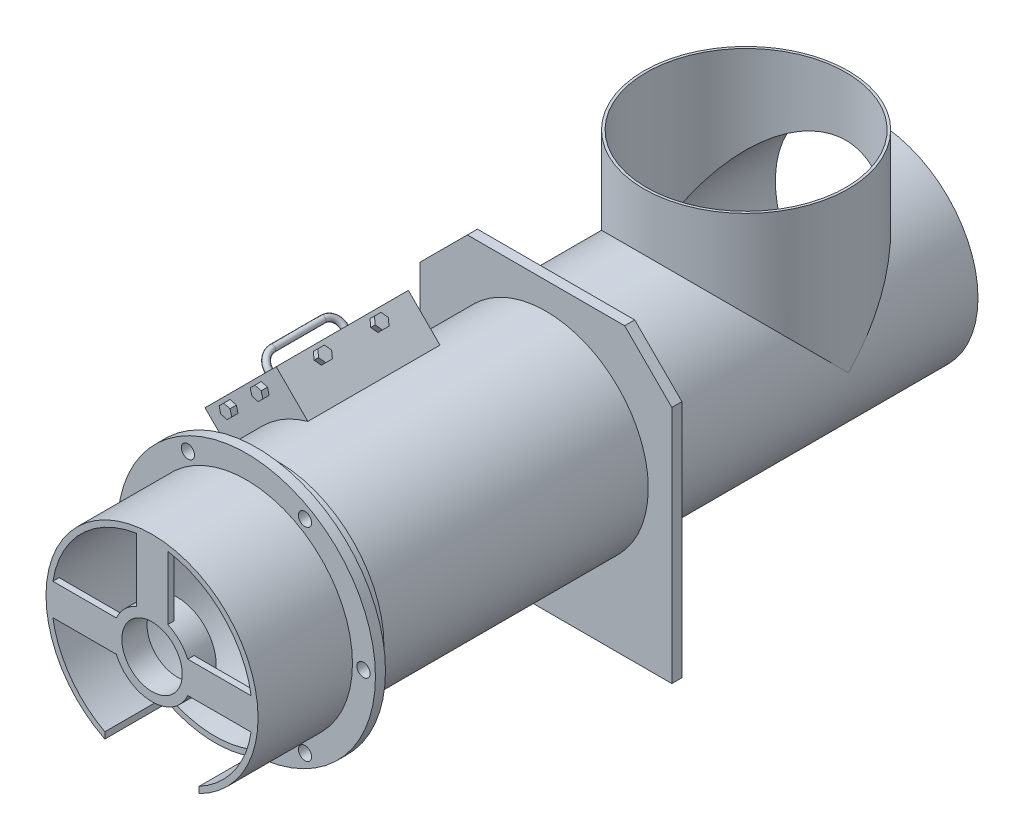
SolidWorks part; units mm, degrees
ref_plane "Front Plane" through (0, 0, 0) normal (0, 0, 1) x (1, 0, 0)
ref_plane "Top Plane" through (0, 0, 0) normal (0, 1, 0) x (1, 0, 0)
ref_plane "Right Plane" through (0, 0, 0) normal (1, 0, 0) x (0, 0, -1)
sketch "Sketch1" plane through (0, 0, 0) normal (0, 0, 1) x (1, 0, 0)
  circle A0 centre (0, 0) radius 162.5
  circle A1 centre (0, 0) radius 159.5
  dimension "D1" = 325
  dimension "D2" = 3
extrude "Boss-Extrude1" add sketch "Sketch1" along normal blind 950 contours A0 | A1
ref_plane "Plane1" through (0, 253, 0) normal (0, 1, 0) x (1, 0, 0)
sketch "Sketch4" plane through (0, 253, 0) normal (0, 1, 0) x (1, 0, 0)
  line L0 (0, 0) -> (0, -206) construction
  circle A0 centre (0, -206) radius 162.5
  point P0 (0, -206)
  dimension "D1" = 325
  dimension "D2" = 206
sketch "Sketch8" plane through (0, 0, 0) normal (1, 0, 0) x (0, 0, -1)
  line L0 (-950, 162.5) -> (-950, -162.5) construction
  line L1 (-950, 159.5) -> (-1150, 159.5)
  line L2 (-950, 159.5) -> (-950, 168.5)
  line L3 (-950, 168.5) -> (-984, 168.5)
  line L4 (-1150, 159.5) -> (-1150, 168.5)
  line L5 (0, 159.5) -> (-950, 159.5) construction
  line L6 (-1000, 168.5) -> (-1150, 168.5)
  line L8 (-1000, 168.5) -> (-1000, 205)
  line L9 (-1000, 205) -> (-984, 205)
  line L10 (-984, 168.5) -> (-984, 205)
  dimension "D1" = 200
  dimension "D2" = 168.5
  dimension "D3" = 150
  dimension "D4" = 16
  dimension "D5" = 205
ref_axis "Axis2" through (0, 0, 950) along (0, 0, -1)
revolve "Revolve2" add sketch "Sketch8" angle 360 about axis through (0, 0, 950) along (0, 0, -1)
sketch "Sketch2" plane through (0, 0, 0) normal (0, 1, 0) x (1, 0, 0)
  line L1 (-75, -1150) -> (75, -1150)
  line L2 (-75, -1150) -> (-75, -1050)
  line L3 (-75, -1050) -> (75, -1050)
  line L4 (75, -1150) -> (75, -1050)
  line L5 (0, -1050) -> (0, 0) construction
  line L6 (-159.5, -1150) -> (159.5, -1150) construction
  dimension "D1" = 100
  dimension "D2" = 150
extrude "Cut-Extrude1" cut sketch "Sketch2" against normal through all
sketch "Sketch11" plane through (0, 0, 1000) normal (0, 0, 1) x (1, 0, 0)
  line L0 (186, 0) -> (0, 0) construction
  circle A0 centre (0, 0) radius 186 construction
  circle A1 centre (186, 0) radius 10.5
  dimension "D1" = 372
  dimension "D2" = 21
extrude "Cut-Extrude4" cut sketch "Sketch11" against normal up to surface (16 mm away)
pattern_circular "CirPattern2" count 6 over 360 about axis through (0, 0, 0) along (0, 0, 1) of "Cut-Extrude4"
ref_plane "Plane2" through (0, 0, 524) normal (0, 0, -1) x (-1, 0, 0)
sketch "Sketch13" plane through (0, 0, 524) normal (0, 0, -1) x (-1, 0, 0)
  line L0 (0, -250) -> (0, 0) construction
  line L1 (-200, -250) -> (200, -250)
  line L2 (-200, -250) -> (-200, 205)
  line L3 (-200, 205) -> (200, 205)
  line L4 (200, -250) -> (200, 205)
  circle A0 centre (0, 0) radius 162.5
  circle A1 centre (0, 0) radius 162.5 construction
  dimension "D1" = 250
  dimension "D2" = 205
  dimension "D3" = 400
extrude "Boss-Extrude3" add sketch "Sketch13" along normal blind 16 separate body
chamfer "Chamfer1" distance 75 angle 45 2 edges at (200, 205, 516) (-200, 205, 516)
sketch "Sketch14" plane through (0, 0, 0) normal (1, 0, 0) x (0, 0, -1)
  line L0 (-1150, 168.5) -> (-1150, -150.8882) construction
  line L1 (-1150, 48) -> (-1110, 48)
  line L2 (-1150, 48) -> (-1150, 62)
  line L3 (-1150, 62) -> (-1110, 62)
  line L4 (-1110, 48) -> (-1110, 62)
  line L5 (-1150, 48) -> (-1110, 62) construction
  line L6 (-1150, 62) -> (-1110, 48) construction
  line L8 (-950, 0) -> (0, 0) construction
  point P0 (-1130, 55)
  dimension "D1" = 48
  dimension "D2" = 62
  dimension "D3" = 40
revolve "Revolve3" add sketch "Sketch14" angle 360 about axis through (0, 0, 950) along (0, 0, -1)
sketch "Sketch15" plane through (0, 0, 1150) normal (0, 0, 1) x (1, 0, 0)
  line L0 (62, 0) -> (0, 0) construction
  line L1 (56.7362, -25) -> (157.5286, -25)
  line L3 (56.7362, 25) -> (157.5286, 25)
  circle A0 centre (0, 0) radius 62 construction
  arc A1 (75, -140.7667) -> (-75, -140.7667) centre (0, 0) ccw construction
  arc A2 (56.7362, 25) -> (56.7362, -25) centre (0, 0) cw
  arc A3 (157.5286, 25) -> (157.5286, -25) centre (0, 0) cw
  dimension "D1" = 50
extrude "Boss-Extrude4" add sketch "Sketch15" against normal blind 10
pattern_circular "CirPattern3" count 4 over 360 about axis through (0, 0, 950) along (0, 0, -1) of "Boss-Extrude4"
ref_plane "Plane3" through (0, 0, 0) normal (-0.7071, 0.7071, 0) x (0, 0, -1)
ref_plane "Plane4" through (-114.9049, 114.9049, 0) normal (-0.7071, 0.7071, 0) x (0, 0, -1)
ref_plane "Plane5" through (-150.2602, 150.2602, 0) normal (-0.7071, 0.7071, 0) x (0, 0, -1)
sketch "Sketch16" plane through (-150.2602, 150.2602, 0) normal (-0.7071, 0.7071, 0) x (0, 0, -1)
  line L0 (-950, 0) -> (0, 0) construction
  line L1 (-859, -80) -> (-649, -80)
  line L2 (-859, -80) -> (-859, 80)
  line L3 (-859, 80) -> (-649, 80)
  line L4 (-649, -80) -> (-649, 80)
  line L5 (-859, -80) -> (-649, 80) construction
  line L6 (-859, 80) -> (-649, -80) construction
  line L7 (-524, -225.5) -> (-524, 225.5) construction
  line L8 (-855, 76) -> (-653, 76)
  line L9 (-653, -76) -> (-653, 76)
  line L10 (-855, -76) -> (-653, -76)
  line L11 (-855, -76) -> (-855, 76)
  point P0 (-754, 0)
  dimension "D1" = 210
  dimension "D2" = 160
  dimension "D3" = 230
  dimension "D4" = 4
extrude "Boss-Extrude5" add sketch "Sketch16" against normal up to next separate body
sketch "Sketch18" plane through (-150.2602, 150.2602, 0) normal (-0.7071, 0.7071, 0) x (0, 0, -1)
  line L0 (-854, 75) -> (-654, 75)
  line L1 (-653, 76) -> (-855, 76) construction
  line L2 (-855, 76) -> (-855, -76) construction
  line L4 (-754, 71) -> (-754, -71) construction
  line L5 (-654, 75) -> (-654, -75)
  line L6 (-854, -75) -> (-654, -75)
  line L7 (-854, 75) -> (-854, -75)
  line L8 (-850, 71) -> (-658, 71)
  line L9 (-658, 71) -> (-658, -71)
  line L10 (-850, -71) -> (-658, -71)
  line L11 (-850, 71) -> (-850, -71)
  line L12 (-850, 0) -> (-658, 0) construction
  dimension "D1" = 150
  dimension "D2" = 4
  dimension "D3" = 200
  dimension "D4" = 1
  dimension "D5" = 1
extrude "Boss-Extrude6" add sketch "Sketch18" against normal up to next separate body
sketch "Sketch19" plane through (-114.9049, 114.9049, 0) normal (-0.7071, 0.7071, 0) x (0, 0, -1)
  line L0 (-950, 0) -> (0, 0) construction
  line L1 (-850, 71) -> (-850, -71) construction
  circle A0 centre (-814, 0) radius 5
  dimension "D1" = 36
  dimension "D2" = 10
ref_plane "Plane6" through (0, 0, 0) normal (0.7071, 0.7071, 0) x (0.7071, -0.7071, 0)
sketch "Sketch20" plane through (0, 0, 0) normal (0.7071, 0.7071, 0) x (0.7071, -0.7071, 0)
  line L0 (-162.5, -814) -> (-212.5, -814)
  line L1 (-162.5, 522.5) -> (-162.5, -522.5) construction
  line L2 (-232.5, -794) -> (-232.5, -714)
  line L3 (-212.5, -694) -> (-162.5, -694)
  arc A0 (-232.5, -714) -> (-212.5, -694) centre (-212.5, -714) cw
  arc A1 (-212.5, -814) -> (-232.5, -794) centre (-212.5, -794) cw
  point P8 (-232.5, -694)
  point P11 (-232.5, -814)
  dimension "D3" = 20
  dimension "D4" = 20
  dimension "D1" = 70
  dimension "D2" = 120
sweep "Sweep1" add profiles "Sketch19" path "Sketch20"
sketch "Sketch21" plane through (56.5685, 56.5685, 0) normal (0.7071, 0.7071, 0) x (0, 0, -1)
  line L0 (-859, 141.4435) -> (-859, 212.5) construction
  line L1 (-793.8038, 188.5) -> (-788.6077, 197.5)
  line L2 (-788.6077, 197.5) -> (-793.8038, 206.5)
  line L3 (-793.8038, 206.5) -> (-804.1962, 206.5)
  line L4 (-804.1962, 206.5) -> (-809.3923, 197.5)
  line L5 (-809.3923, 197.5) -> (-804.1962, 188.5)
  line L6 (-804.1962, 188.5) -> (-793.8038, 188.5)
  line L7 (-859, 212.5) -> (-649, 212.5) construction
  circle A0 centre (-799, 197.5) radius 9 construction
  dimension "D2" = 18
  dimension "D1" = 60
  dimension "D3" = 15
extrude "Boss-Extrude7" add sketch "Sketch21" along normal blind 10
pattern_linear "LPattern1" count 2 spacing 19 along (-0.7071, -0.7071, 0) of "Boss-Extrude7"
sketch "Sketch22" plane through (43.1335, 43.1335, 0) normal (-0.7071, -0.7071, 0) x (0, 0, 1)
  line L0 (788.6077, 197.5) -> (809.3923, 197.5) construction
  circle A0 centre (799, 197.5) radius 5
  dimension "D1" = 10
extrude "Boss-Extrude8" add sketch "Sketch22" along normal blind 10
pattern_linear "LPattern2" count 2 spacing 90 along (0, 0, -1) of "LPattern1", "Boss-Extrude8", "Boss-Extrude7"
sketch "Sketch23" plane through (0, 0, 859) normal (0, 0, 1) x (1, 0, 0)
  line L0 (-206.8287, 93.6916) -> (-93.6916, 206.8287) construction
  line L1 (-124.943, 167.0921) -> (-122.2533, 157.0539)
  line L2 (-122.2533, 157.0539) -> (-112.2151, 154.3641)
  line L3 (-112.2151, 154.3641) -> (-104.8667, 161.7126)
  line L4 (-104.8667, 161.7126) -> (-107.5564, 171.7508)
  line L5 (-107.5564, 171.7508) -> (-117.5946, 174.4405)
  line L6 (-117.5946, 174.4405) -> (-124.943, 167.0921)
  line L7 (-43.4471, 156.5842) -> (-93.6916, 206.8287) construction
  circle A0 centre (-114.9049, 164.4023) radius 9 construction
  dimension "D1" = 18
  dimension "D2" = 15
  dimension "D3" = 45
extrude "Boss-Extrude9" add sketch "Sketch23" along normal blind 10 contours L3 L4 L5 L6 L1 L2
pattern_linear "LPattern3" count 2 spacing 19 along (0, 0, -1) of "Boss-Extrude9"
sketch "Sketch24" plane through (0, 0, 840) normal (0, 0, -1) x (-1, 0, 0)
  line L0 (107.5564, 171.7508) -> (122.2533, 157.0539) construction
  circle A0 centre (114.9049, 164.4023) radius 5
  dimension "D1" = 10
extrude "Boss-Extrude10" add sketch "Sketch24" along normal blind 10
pattern_linear "LPattern4" count 2 spacing 70 along (-0.7071, -0.7071, 0) of "Boss-Extrude9", "LPattern3", "Boss-Extrude10"
mirror "Mirror1" about plane through (0, 0, 0) normal (0.7071, 0.7071, 0) of "LPattern2", "Boss-Extrude7", "LPattern1", "Boss-Extrude8"
ref_plane "Plane7" through (0, 0, 754) normal (0, 0, 1) x (1, 0, 0)
mirror "Mirror2" about plane through (0, 0, 754) normal (0, 0, 1) of "LPattern4", "Boss-Extrude9", "LPattern3", "Boss-Extrude10"
extrude "Boss-Extrude11" add sketch "Sketch4" against normal up to surface (90.5 mm away) contours A0
sketch "Sketch25" plane through (0, 253, 0) normal (0, 1, 0) x (1, 0, 0)
  circle A0 centre (0, -206) radius 158.5
  dimension "D1" = 317
extrude "Cut-Extrude5" cut sketch "Sketch25" against normal up to surface (253 mm away)
